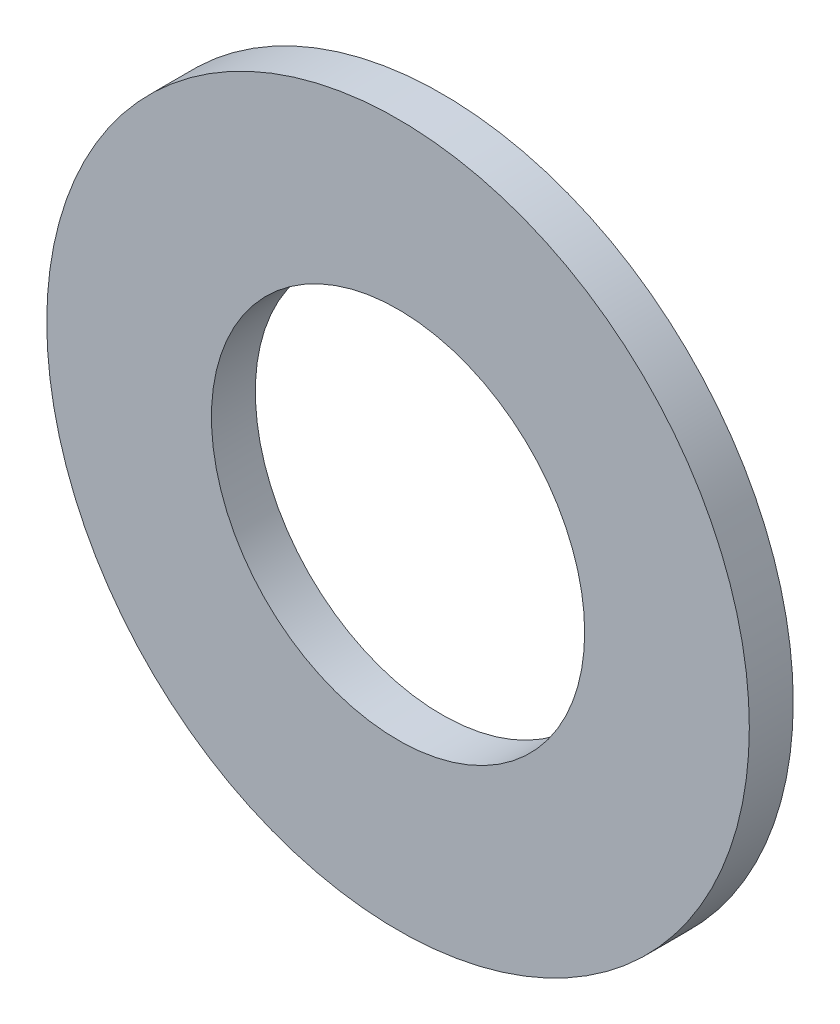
SolidWorks part; units mm, degrees
ref_plane "Front Plane" through (0, 0, 0) normal (1, 0, 0) x (0, 1, 0)
ref_plane "Top Plane" through (0, 0, 0) normal (0, 0, 1) x (0, 1, 0)
ref_plane "Right Plane" through (0, 0, 0) normal (0, 1, 0) x (-1, 0, 0)
sketch "Sketch1" plane through (0, 0, 0) normal (0, 0, 1) x (0, 1, 0)
  circle A0 centre (0, 0) radius 26.9875
  circle A1 centre (0, 0) radius 50.8
  dimension "D1" = 53.975
  dimension "D2" = 101.6
extrude "Boss-Extrude1" add sketch "Sketch1" along normal mid plane 6.35
